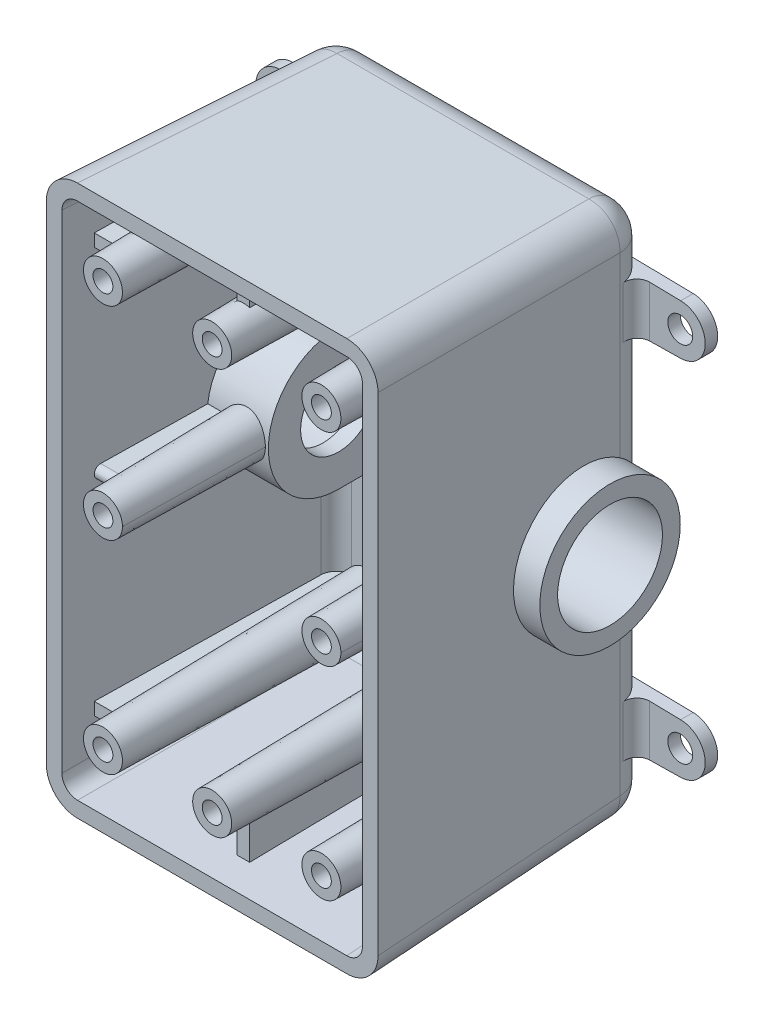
SolidWorks part; units mm, degrees
ref_plane "Front Plane" through (0, 0, 0) normal (0, 0, 1) x (1, 0, 0)
ref_plane "Top Plane" through (0, 0, 0) normal (0, 1, 0) x (1, 0, 0)
ref_plane "Right Plane" through (0, 0, 0) normal (1, 0, 0) x (0, 0, -1)
imported_body "Imported1"
other "Move Face1" parameters "D1"=6.35
other "Move Face2" parameters "D1"=6.35
ref_plane "Plane1" through (38.1, 0, 0) normal (1, 0, 0) x (0, 0, -1)
sketch "Sketch1" plane through (38.1, 0, 0) normal (1, 0, 0) x (0, 0, -1)
  circle A0 centre (-14.2875, 0) radius 14.2875
  arc A3 (-14.2875, 14.2875) -> (-14.2875, -14.2875) centre (-14.2875, 0) ccw construction
extrude "Extrude1" add sketch "Sketch1" against normal up to next
sketch "Sketch2" plane through (38.1, 0, 0) normal (1, 0, 0) x (0, 0, -1)
  circle A0 centre (-14.2875, 0) radius 10.668
  dimension "D1" = 21.336
extrude "Cut-Extrude1" cut sketch "Sketch2" against normal offset from surface (17.78 mm away) 3.175
mirror "Mirror2" about plane through (0, 0, 0) normal (1, 0, 0) of "Extrude1"
sketch "Sketch4" plane through (-38.1, 0, 0) normal (-1, 0, 0) x (0, 0, 1)
  circle A0 centre (14.2875, 0) radius 10.668 construction
  circle A1 centre (14.2875, 0) radius 10.668
extrude "Cut-Extrude3" cut sketch "Sketch4" against normal offset from surface (17.78 mm away) 3.175
sketch "Sketch3" plane through (20.32, 0, 0) normal (1, 0, 0) x (0, 0, -1)
  circle A0 centre (-14.2875, 0) radius 7.7216
  dimension "D1" = 15.4432
extrude "Cut-Extrude2" cut sketch "Sketch3" against normal through all
sketch "Sketch5" plane through (0, 0, 0) normal (1, 0, 0) x (0, 0, -1)
  circle A0 centre (-14.2875, 0) radius 14.2875 construction
  circle A1 centre (-14.2875, 0) radius 14.2875 construction
